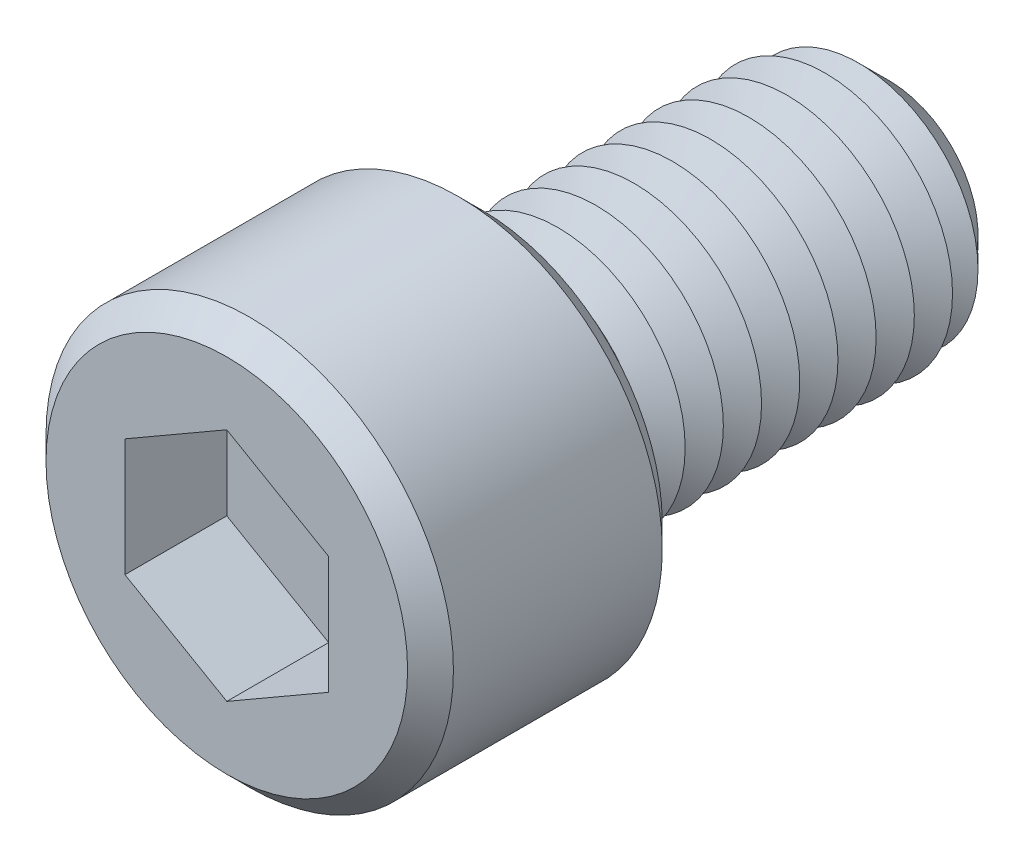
SolidWorks part; units mm, degrees
ref_plane "Front Plane" through (0, 0, 0) normal (0, 0, 1) x (1, 0, 0)
ref_plane "Top Plane" through (0, 0, 0) normal (0, 1, 0) x (1, 0, 0)
ref_plane "Right Plane" through (0, 0, 0) normal (1, 0, 0) x (0, 0, -1)
sketch "Sketch1" plane through (0, 0, 0) normal (0, 0, 1) x (1, 0, 0)
  circle A0 centre (0, 0) radius 8
  dimension "D1" = 16
extrude "Boss-Extrude1" add sketch "Sketch1" along normal blind 10
sketch "Sketch2" plane through (0, 0, 0) normal (0, 0, -1) x (-1, 0, 0)
  circle A0 centre (0, 0) radius 5
  dimension "D1" = 10
extrude "Boss-Extrude2" add sketch "Sketch2" along normal blind 16
chamfer "Chamfer1" distance 1.5 angle 45 1 edges at (-5, 0, -16)
sketch "Sketch3" plane through (0, 0, 0) normal (1, 0, 0) x (0, 0, -1)
  line L0 (-2.5121, 0) -> (4.5776, 0) construction
sketch "Sketch4" plane through (0, 0, 0) normal (1, 0, 0) x (0, 0, -1)
  line L0 (0, 5) -> (0.75, 3.701)
  line L1 (0.75, 3.701) -> (1.5, 5)
  line L2 (14.5, 5) -> (0, 5) construction
  line L3 (1.5, 5) -> (0, 5)
  dimension "D1" = 1.5
revolve "Cut-Revolve1" cut sketch "Sketch4" angle 360 about L0
pattern_linear "LPattern1" count 10 spacing 1.5 along (0, 0, -1) of "Cut-Revolve1"
sketch "Sketch5" plane through (0, 0, 10) normal (0, 0, 1) x (1, 0, 0)
  line L1 (0, 4.6188) -> (-4, 2.3094)
  line L2 (-4, 2.3094) -> (-4, -2.3094)
  line L3 (-4, -2.3094) -> (0, -4.6188)
  line L4 (0, -4.6188) -> (4, -2.3094)
  line L5 (4, -2.3094) -> (4, 2.3094)
  line L6 (4, 2.3094) -> (0, 4.6188)
  circle A0 centre (0, 0) radius 4 construction
  dimension "D1" = 8
extrude "Cut-Extrude1" cut sketch "Sketch5" against normal blind 4
sketch "Sketch6" plane through (0, 0, 6) normal (0, 0, 1) x (1, 0, 0)
  circle A0 centre (0, 0) radius 0.9
  dimension "D1" = 1.8
extrude "Cut-Extrude2" cut sketch "Sketch6" against normal up to surface (22 mm away)
chamfer "Chamfer2" distance 0.9 angle 45 2 edges at (8, 0, 0) (8, 0, 10)
